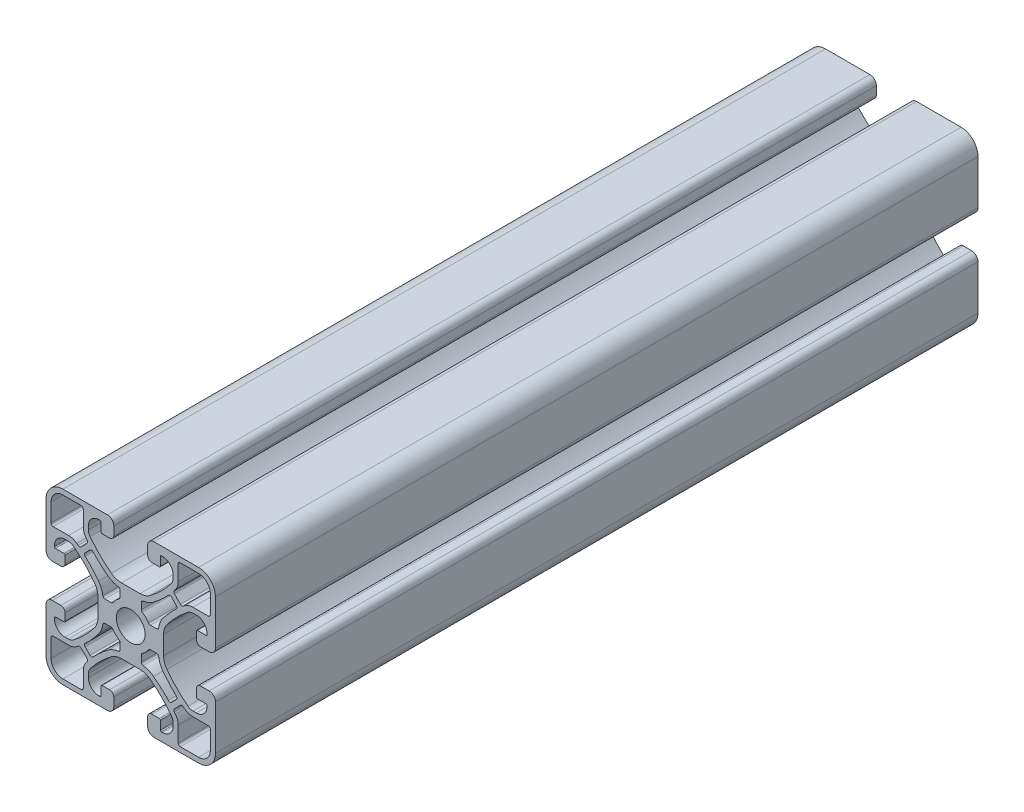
SolidWorks part; units mm, degrees
ref_plane "Face" through (0, 0, 0) normal (0, 0, 1) x (1, 0, 0)
ref_plane "Dessus" through (0, 0, 0) normal (0, 1, 0) x (1, 0, 0)
ref_plane "Droite" through (0, 0, 0) normal (1, 0, 0) x (0, 0, -1)
sketch "Esquisse profilé" plane through (0, 0, 0) normal (0, 0, 1) x (1, 0, 0)
  line L0 (11.6997, 18.8) -> (16, 18.8)
  line L1 (18.8, 16) -> (18.8, 11.7)
  line L2 (18.3, 11.2) -> (14.67, 11.2)
  line L3 (12.3957, 10.2874) -> (12.7389, 10.5517)
  line L4 (11.7339, 10.3275) -> (10.3272, 11.7342)
  line L5 (10.5513, 12.7393) -> (10.2871, 12.3961)
  line L6 (11.1997, 14.6704) -> (11.1997, 18.3)
  line L7 (-11.1997, 14.6699) -> (-11.1997, 18.3)
  line L8 (-10.5517, 12.7393) -> (-10.2874, 12.3961)
  line L9 (-11.7342, 10.3275) -> (-10.3275, 11.7342)
  line L10 (-12.3961, 10.2874) -> (-12.7393, 10.5517)
  line L11 (-18.3, 11.2) -> (-14.6704, 11.2)
  line L12 (-18.8, 16) -> (-18.8, 11.7)
  line L13 (-11.6997, 18.8) -> (-16, 18.8)
  line L14 (-2.5, 6.0982) -> (-2.5, 4.6098)
  line L15 (-4.6098, 2.5) -> (-6.0982, 2.5)
  line L16 (-10.7615, 9.6032) -> (-9.6032, 10.7615)
  line L17 (-10.7615, -9.6032) -> (-9.6032, -10.7615)
  line L18 (-4.6098, -2.5) -> (-6.0982, -2.5)
  line L19 (-2.5, -6.0982) -> (-2.5, -4.6098)
  line L20 (-11.7, -18.8) -> (-16, -18.8)
  line L21 (-18.8, -16) -> (-18.8, -11.7)
  line L22 (-18.3, -11.2) -> (-14.6704, -11.2)
  line L23 (-12.3961, -10.2874) -> (-12.7393, -10.5517)
  line L24 (-11.7342, -10.3275) -> (-10.3275, -11.7342)
  line L25 (-10.5517, -12.7393) -> (-10.2874, -12.3961)
  line L26 (-11.2, -14.6704) -> (-11.2, -18.3)
  line L27 (9.6032, 10.7615) -> (10.7615, 9.6032)
  line L28 (6.0982, 2.5) -> (4.6098, 2.5)
  line L29 (2.5, 4.6098) -> (2.5, 6.0982)
  line L30 (2.5, -4.6098) -> (2.5, -6.0982)
  line L31 (6.0982, -2.5) -> (4.6098, -2.5)
  line L32 (9.6032, -10.7615) -> (10.7615, -9.6032)
  line L33 (11.1997, -14.6704) -> (11.1997, -18.3)
  line L34 (10.5513, -12.7393) -> (10.2871, -12.3961)
  line L35 (11.7339, -10.3275) -> (10.3272, -11.7342)
  line L36 (12.3957, -10.2874) -> (12.7389, -10.5517)
  line L37 (18.3, -11.2) -> (14.67, -11.2)
  line L38 (18.8, -16) -> (18.8, -11.7)
  line L39 (11.6997, -18.8) -> (16, -18.8)
  line L40 (5.5, -20) -> (16, -20)
  line L41 (4, -16.5) -> (4, -18.5)
  line L42 (6.75, -15.5) -> (5, -15.5)
  line L43 (7, -17.75) -> (7, -15.75)
  line L44 (7.5, -18) -> (7.25, -18)
  line L45 (10, -14.7204) -> (10, -15.5)
  line L46 (-2.1931, -7.75) -> (2.1931, -7.75)
  line L47 (-10, -15.5) -> (-10, -14.7204)
  line L48 (-7.25, -18) -> (-7.5, -18)
  line L49 (-7, -15.75) -> (-7, -17.75)
  line L50 (-5, -15.5) -> (-6.75, -15.5)
  line L51 (-4, -18.5) -> (-4, -16.5)
  line L52 (-16, -20) -> (-5.5, -20)
  line L53 (-20, -5.5) -> (-20, -16)
  line L54 (-16.5, -4) -> (-18.5, -4)
  line L55 (-15.5, -6.75) -> (-15.5, -5)
  line L56 (-17.75, -7) -> (-15.75, -7)
  line L57 (-18, -7.5) -> (-18, -7.25)
  line L58 (-14.7204, -10) -> (-15.5, -10)
  line L59 (-7.75, 2.1931) -> (-7.75, -2.1931)
  line L60 (-15.5, 10) -> (-14.7204, 10)
  line L61 (-18, 7.25) -> (-18, 7.5)
  line L62 (-15.75, 7) -> (-17.75, 7)
  line L63 (-15.5, 5) -> (-15.5, 6.75)
  line L64 (-18.5, 4) -> (-16.5, 4)
  line L65 (-20, 16) -> (-20, 5.5)
  line L66 (-5.5, 20) -> (-16, 20)
  line L67 (-4, 16.5) -> (-4, 18.5)
  line L68 (-6.75, 15.5) -> (-5, 15.5)
  line L69 (-7, 17.75) -> (-7, 15.75)
  line L70 (-7.5, 18) -> (-7.25, 18)
  line L71 (-10, 14.7204) -> (-10, 15.5)
  line L72 (2.1931, 7.75) -> (-2.1931, 7.75)
  line L73 (10, 15.5) -> (10, 14.7204)
  line L74 (7.25, 18) -> (7.5, 18)
  line L75 (7, 15.75) -> (7, 17.75)
  line L76 (5, 15.5) -> (6.75, 15.5)
  line L77 (4, 18.5) -> (4, 16.5)
  line L78 (16, 20) -> (5.5, 20)
  line L79 (20, 5.5) -> (20, 16)
  line L80 (16.5, 4) -> (18.5, 4)
  line L81 (15.5, 6.75) -> (15.5, 5)
  line L82 (17.75, 7) -> (15.75, 7)
  line L83 (18, 7.5) -> (18, 7.25)
  line L84 (14.7204, 10) -> (15.5, 10)
  line L85 (7.75, -2.1931) -> (7.75, 2.1931)
  line L86 (15.5, -10) -> (14.7204, -10)
  line L87 (18, -7.25) -> (18, -7.5)
  line L88 (15.75, -7) -> (17.75, -7)
  line L89 (15.5, -5) -> (15.5, -6.75)
  line L90 (18.5, -4) -> (16.5, -4)
  line L91 (20, -16) -> (20, -5.5)
  arc A0 (11.1997, 18.3) -> (11.6997, 18.8) centre (11.6997, 18.3) cw
  arc A1 (-11.1997, 14.6699) -> (-10.5517, 12.7393) centre (-7.9997, 14.6699) ccw
  arc A2 (16, 18.8) -> (18.8, 16) centre (16, 16) cw
  arc A3 (18.8, 11.7) -> (18.3, 11.2) centre (18.3, 11.7) cw
  arc A4 (12.7389, 10.5517) -> (14.67, 11.2) centre (14.67, 8) cw
  arc A5 (12.3957, 10.2874) -> (11.7339, 10.3275) centre (12.0874, 10.6811) cw
  arc A6 (10.3272, 11.7342) -> (10.2871, 12.3961) centre (10.6807, 12.0878) cw
  arc A7 (11.1997, 14.6704) -> (10.5513, 12.7393) centre (7.9997, 14.6704) cw
  arc A8 (-10.3275, 11.7342) -> (-10.2874, 12.3961) centre (-10.6811, 12.0878) ccw
  arc A9 (-12.3961, 10.2874) -> (-11.7342, 10.3275) centre (-12.0878, 10.6811) ccw
  arc A10 (-12.7393, 10.5517) -> (-14.6704, 11.2) centre (-14.6704, 8) ccw
  arc A11 (-18.8, 11.7) -> (-18.3, 11.2) centre (-18.3, 11.7) ccw
  arc A12 (-16, 18.8) -> (-18.8, 16) centre (-16, 16) ccw
  arc A13 (-11.1997, 18.3) -> (-11.6997, 18.8) centre (-11.6997, 18.3) ccw
  arc A14 (-8.8828, 10.7477) -> (-5.38, 7.59) centre (10.34, 28.55) ccw
  arc A15 (-5.38, 7.59) -> (-2.9351, 6.594) centre (-2.26, 11.75) ccw
  arc A16 (-2.5, 6.0982) -> (-2.9351, 6.594) centre (-3, 6.0982) ccw
  arc A17 (-2.7273, 4.1907) -> (-2.5, 4.6098) centre (-3, 4.6098) ccw
  arc A18 (-2.7273, 4.1907) -> (-4.1907, 2.7273) centre (0, 0) ccw
  arc A19 (-4.6098, 2.5) -> (-4.1907, 2.7273) centre (-4.6098, 3) ccw
  arc A20 (-6.594, 2.9351) -> (-6.0982, 2.5) centre (-6.0982, 3) ccw
  arc A21 (-6.594, 2.9351) -> (-7.59, 5.38) centre (-11.75, 2.26) ccw
  arc A22 (-7.59, 5.38) -> (-10.7477, 8.8828) centre (-28.55, -10.34) ccw
  arc A23 (-10.7615, 9.6032) -> (-10.7477, 8.8828) centre (-10.4079, 9.2497) ccw
  arc A24 (-8.8828, 10.7477) -> (-9.6032, 10.7615) centre (-9.2497, 10.4079) ccw
  arc A25 (-8.8828, -10.7477) -> (-9.6032, -10.7615) centre (-9.2497, -10.4079) cw
  arc A26 (-10.7615, -9.6032) -> (-10.7477, -8.8828) centre (-10.4079, -9.2497) cw
  arc A27 (-7.59, -5.38) -> (-10.7477, -8.8828) centre (-28.55, 10.34) cw
  arc A28 (-6.594, -2.9351) -> (-7.59, -5.38) centre (-11.75, -2.26) cw
  arc A29 (-6.594, -2.9351) -> (-6.0982, -2.5) centre (-6.0982, -3) cw
  arc A30 (-4.6098, -2.5) -> (-4.1907, -2.7273) centre (-4.6098, -3) cw
  arc A31 (-2.7273, -4.1907) -> (-4.1907, -2.7273) centre (0, 0) cw
  arc A32 (-2.7273, -4.1907) -> (-2.5, -4.6098) centre (-3, -4.6098) cw
  arc A33 (-2.5, -6.0982) -> (-2.9351, -6.594) centre (-3, -6.0982) cw
  arc A34 (-5.38, -7.59) -> (-2.9351, -6.594) centre (-2.26, -11.75) cw
  arc A35 (-8.8828, -10.7477) -> (-5.38, -7.59) centre (10.34, -28.55) cw
  arc A36 (-11.2, -18.3) -> (-11.7, -18.8) centre (-11.7, -18.3) cw
  arc A37 (-16, -18.8) -> (-18.8, -16) centre (-16, -16) cw
  arc A38 (-18.8, -11.7) -> (-18.3, -11.2) centre (-18.3, -11.7) cw
  arc A39 (-12.7393, -10.5517) -> (-14.6704, -11.2) centre (-14.6704, -8) cw
  arc A40 (-12.3961, -10.2874) -> (-11.7342, -10.3275) centre (-12.0878, -10.6811) cw
  arc A41 (-10.3275, -11.7342) -> (-10.2874, -12.3961) centre (-10.6811, -12.0878) cw
  arc A42 (-11.2, -14.6704) -> (-10.5517, -12.7393) centre (-8, -14.6704) cw
  arc A43 (10.7477, 8.8828) -> (10.7615, 9.6032) centre (10.4079, 9.2497) ccw
  arc A44 (10.7477, 8.8828) -> (7.59, 5.38) centre (28.55, -10.34) ccw
  arc A45 (7.59, 5.38) -> (6.594, 2.9351) centre (11.75, 2.26) ccw
  arc A46 (6.0982, 2.5) -> (6.594, 2.9351) centre (6.0982, 3) ccw
  arc A47 (4.1907, 2.7273) -> (4.6098, 2.5) centre (4.6098, 3) ccw
  arc A48 (4.1907, 2.7273) -> (2.7273, 4.1907) centre (0, 0) ccw
  arc A49 (2.5, 4.6098) -> (2.7273, 4.1907) centre (3, 4.6098) ccw
  arc A50 (2.9351, 6.594) -> (2.5, 6.0982) centre (3, 6.0982) ccw
  arc A51 (2.9351, 6.594) -> (5.38, 7.59) centre (2.26, 11.75) ccw
  arc A52 (5.38, 7.59) -> (8.8828, 10.7477) centre (-10.34, 28.55) ccw
  arc A53 (9.6032, 10.7615) -> (8.8828, 10.7477) centre (9.2497, 10.4079) ccw
  arc A54 (9.6032, -10.7615) -> (8.8828, -10.7477) centre (9.2497, -10.4079) cw
  arc A55 (5.38, -7.59) -> (8.8828, -10.7477) centre (-10.34, -28.55) cw
  arc A56 (2.9351, -6.594) -> (5.38, -7.59) centre (2.26, -11.75) cw
  arc A57 (2.9351, -6.594) -> (2.5, -6.0982) centre (3, -6.0982) cw
  arc A58 (2.5, -4.6098) -> (2.7273, -4.1907) centre (3, -4.6098) cw
  arc A59 (4.1907, -2.7273) -> (2.7273, -4.1907) centre (0, 0) cw
  arc A60 (4.1907, -2.7273) -> (4.6098, -2.5) centre (4.6098, -3) cw
  arc A61 (6.0982, -2.5) -> (6.594, -2.9351) centre (6.0982, -3) cw
  arc A62 (7.59, -5.38) -> (6.594, -2.9351) centre (11.75, -2.26) cw
  arc A63 (10.7477, -8.8828) -> (7.59, -5.38) centre (28.55, 10.34) cw
  arc A64 (10.7477, -8.8828) -> (10.7615, -9.6032) centre (10.4079, -9.2497) cw
  arc A65 (11.1997, -14.6704) -> (10.5513, -12.7393) centre (7.9997, -14.6704) ccw
  arc A66 (10.3272, -11.7342) -> (10.2871, -12.3961) centre (10.6807, -12.0878) ccw
  arc A67 (12.3957, -10.2874) -> (11.7339, -10.3275) centre (12.0874, -10.6811) ccw
  arc A68 (12.7389, -10.5517) -> (14.67, -11.2) centre (14.67, -8) ccw
  arc A69 (18.8, -11.7) -> (18.3, -11.2) centre (18.3, -11.7) ccw
  arc A70 (16, -18.8) -> (18.8, -16) centre (16, -16) ccw
  arc A71 (11.1997, -18.3) -> (11.6997, -18.8) centre (11.6997, -18.3) ccw
  circle A72 centre (0, 0) radius 3.4
  arc A73 (16, -20) -> (20, -16) centre (16, -16) ccw
  arc A74 (4, -18.5) -> (5.5, -20) centre (5.5, -18.5) ccw
  arc A75 (5, -15.5) -> (4, -16.5) centre (5, -16.5) ccw
  arc A76 (7, -15.75) -> (6.75, -15.5) centre (6.75, -15.75) ccw
  arc A77 (7, -17.75) -> (7.25, -18) centre (7.25, -17.75) ccw
  arc A78 (7.5, -18) -> (10, -15.5) centre (7.5, -15.5) ccw
  arc A79 (10, -14.7204) -> (9.5948, -13.5134) centre (8, -14.7204) ccw
  arc A80 (9.5948, -13.5134) -> (4.5803, -8.5405) centre (-10.34, -28.6) ccw
  arc A81 (4.5803, -8.5405) -> (2.1931, -7.75) centre (2.1931, -11.75) ccw
  arc A82 (-2.1931, -7.75) -> (-4.5803, -8.5405) centre (-2.1931, -11.75) ccw
  arc A83 (-4.5803, -8.5405) -> (-9.5948, -13.5134) centre (10.34, -28.6) ccw
  arc A84 (-9.5948, -13.5134) -> (-10, -14.7204) centre (-8, -14.7204) ccw
  arc A85 (-10, -15.5) -> (-7.5, -18) centre (-7.5, -15.5) ccw
  arc A86 (-7.25, -18) -> (-7, -17.75) centre (-7.25, -17.75) ccw
  arc A87 (-6.75, -15.5) -> (-7, -15.75) centre (-6.75, -15.75) ccw
  arc A88 (-4, -16.5) -> (-5, -15.5) centre (-5, -16.5) ccw
  arc A89 (-5.5, -20) -> (-4, -18.5) centre (-5.5, -18.5) ccw
  arc A90 (-20, -16) -> (-16, -20) centre (-16, -16) ccw
  arc A91 (-18.5, -4) -> (-20, -5.5) centre (-18.5, -5.5) ccw
  arc A92 (-15.5, -5) -> (-16.5, -4) centre (-16.5, -5) ccw
  arc A93 (-15.75, -7) -> (-15.5, -6.75) centre (-15.75, -6.75) ccw
  arc A94 (-17.75, -7) -> (-18, -7.25) centre (-17.75, -7.25) ccw
  arc A95 (-18, -7.5) -> (-15.5, -10) centre (-15.5, -7.5) ccw
  arc A96 (-14.7204, -10) -> (-13.5134, -9.5948) centre (-14.7204, -8) ccw
  arc A97 (-13.5134, -9.5948) -> (-8.5405, -4.5803) centre (-28.6, 10.34) ccw
  arc A98 (-8.5405, -4.5803) -> (-7.75, -2.1931) centre (-11.75, -2.1931) ccw
  arc A99 (-7.75, 2.1931) -> (-8.5405, 4.5803) centre (-11.75, 2.1931) ccw
  arc A100 (-8.5405, 4.5803) -> (-13.5134, 9.5948) centre (-28.6, -10.34) ccw
  arc A101 (-13.5134, 9.5948) -> (-14.7204, 10) centre (-14.7204, 8) ccw
  arc A102 (-15.5, 10) -> (-18, 7.5) centre (-15.5, 7.5) ccw
  arc A103 (-18, 7.25) -> (-17.75, 7) centre (-17.75, 7.25) ccw
  arc A104 (-15.5, 6.75) -> (-15.75, 7) centre (-15.75, 6.75) ccw
  arc A105 (-16.5, 4) -> (-15.5, 5) centre (-16.5, 5) ccw
  arc A106 (-20, 5.5) -> (-18.5, 4) centre (-18.5, 5.5) ccw
  arc A107 (-16, 20) -> (-20, 16) centre (-16, 16) ccw
  arc A108 (-4, 18.5) -> (-5.5, 20) centre (-5.5, 18.5) ccw
  arc A109 (-5, 15.5) -> (-4, 16.5) centre (-5, 16.5) ccw
  arc A110 (-7, 15.75) -> (-6.75, 15.5) centre (-6.75, 15.75) ccw
  arc A111 (-7, 17.75) -> (-7.25, 18) centre (-7.25, 17.75) ccw
  arc A112 (-7.5, 18) -> (-10, 15.5) centre (-7.5, 15.5) ccw
  arc A113 (-10, 14.7204) -> (-9.5948, 13.5134) centre (-8, 14.7204) ccw
  arc A114 (-9.5948, 13.5134) -> (-4.5803, 8.5405) centre (10.34, 28.6) ccw
  arc A115 (-4.5803, 8.5405) -> (-2.1931, 7.75) centre (-2.1931, 11.75) ccw
  arc A116 (2.1931, 7.75) -> (4.5803, 8.5405) centre (2.1931, 11.75) ccw
  arc A117 (4.5803, 8.5405) -> (9.5948, 13.5134) centre (-10.34, 28.6) ccw
  arc A118 (9.5948, 13.5134) -> (10, 14.7204) centre (8, 14.7204) ccw
  arc A119 (10, 15.5) -> (7.5, 18) centre (7.5, 15.5) ccw
  arc A120 (7.25, 18) -> (7, 17.75) centre (7.25, 17.75) ccw
  arc A121 (6.75, 15.5) -> (7, 15.75) centre (6.75, 15.75) ccw
  arc A122 (4, 16.5) -> (5, 15.5) centre (5, 16.5) ccw
  arc A123 (5.5, 20) -> (4, 18.5) centre (5.5, 18.5) ccw
  arc A124 (20, 16) -> (16, 20) centre (16, 16) ccw
  arc A125 (18.5, 4) -> (20, 5.5) centre (18.5, 5.5) ccw
  arc A126 (15.5, 5) -> (16.5, 4) centre (16.5, 5) ccw
  arc A127 (15.75, 7) -> (15.5, 6.75) centre (15.75, 6.75) ccw
  arc A128 (17.75, 7) -> (18, 7.25) centre (17.75, 7.25) ccw
  arc A129 (18, 7.5) -> (15.5, 10) centre (15.5, 7.5) ccw
  arc A130 (14.7204, 10) -> (13.5134, 9.5948) centre (14.7204, 8) ccw
  arc A131 (13.5134, 9.5948) -> (8.5405, 4.5803) centre (28.6, -10.34) ccw
  arc A132 (8.5405, 4.5803) -> (7.75, 2.1931) centre (11.75, 2.1931) ccw
  arc A133 (7.75, -2.1931) -> (8.5405, -4.5803) centre (11.75, -2.1931) ccw
  arc A134 (8.5405, -4.5803) -> (13.5134, -9.5948) centre (28.6, 10.34) ccw
  arc A135 (13.5134, -9.5948) -> (14.7204, -10) centre (14.7204, -8) ccw
  arc A136 (15.5, -10) -> (18, -7.5) centre (15.5, -7.5) ccw
  arc A137 (18, -7.25) -> (17.75, -7) centre (17.75, -7.25) ccw
  arc A138 (15.5, -6.75) -> (15.75, -7) centre (15.75, -6.75) ccw
  arc A139 (16.5, -4) -> (15.5, -5) centre (16.5, -5) ccw
  arc A140 (20, -5.5) -> (18.5, -4) centre (18.5, -5.5) ccw
extrude "Extrusion1" add sketch "Esquisse profilé" along normal blind 180
